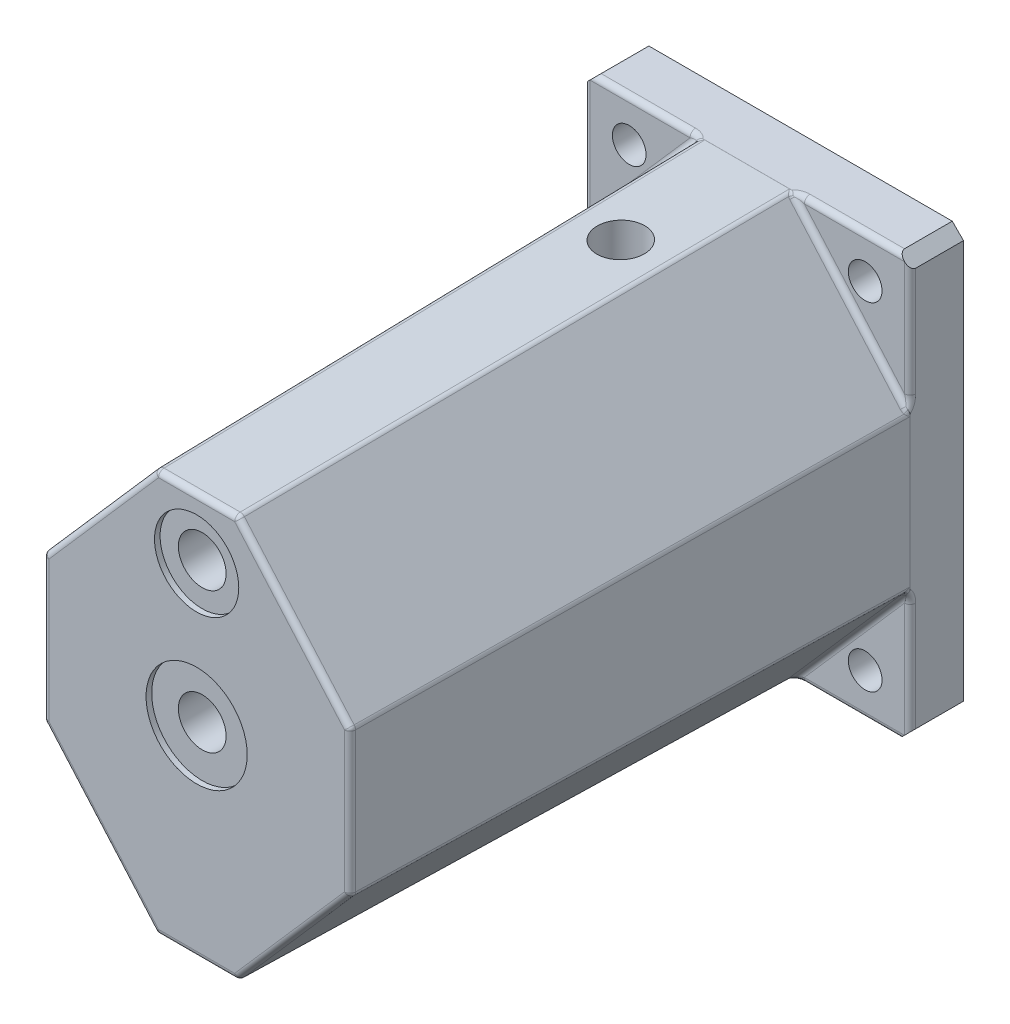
SolidWorks part; units mm, degrees
ref_plane "Face" through (0, 0, 0) normal (0, 0, 1) x (1, 0, 0)
ref_plane "Dessus" through (0, 0, 0) normal (0, 1, 0) x (1, 0, 0)
ref_plane "Droite" through (0, 0, 0) normal (1, 0, 0) x (0, 0, -1)
sketch "Esquisse1" plane through (0, 0, 0) normal (0, 0, 1) x (1, 0, 0)
  line L0 (0, 0) -> (0, 42.8954) construction
  line L1 (-29, 37.5) -> (29, 37.5)
  line L2 (-29, 37.5) -> (-29, -37.5)
  line L3 (-29, -37.5) -> (29, -37.5)
  line L4 (29, 37.5) -> (29, -37.5)
  line L5 (0, 0) -> (74.0043, 0) construction
  dimension "D1" = 58
  dimension "D2" = 75
extrude "Extrusion1" add sketch "Esquisse1" along normal blind 9.5
sketch "Esquisse2" plane through (0, 0, 9.5) normal (0, 0, 1) x (1, 0, 0)
  line L0 (-8, 37.5) -> (8, 37.5)
  line L1 (29, 37.5) -> (-29, 37.5) construction
  line L2 (8, 37.5) -> (29, 13.5)
  line L3 (29, -37.5) -> (29, 37.5) construction
  line L4 (29, 13.5) -> (29, -13.5)
  line L5 (29, -13.5) -> (8, -37.5)
  line L6 (-29, -37.5) -> (29, -37.5) construction
  line L7 (8, -37.5) -> (-8, -37.5)
  line L8 (-8, -37.5) -> (-29, -13.5)
  line L9 (-29, 37.5) -> (-29, -37.5) construction
  line L10 (-29, -13.5) -> (-29, 13.5)
  line L11 (-29, 13.5) -> (-8, 37.5)
  line L12 (0, 0) -> (0, 41.4667) construction
  line L13 (0, 0) -> (42.8837, 0) construction
  dimension "D1" = 16
  dimension "D2" = 27
extrude "Extrusion2" add sketch "Esquisse2" along normal blind 98 draft 1
sketch "Esquisse3" plane through (0, 0, 0) normal (0, 0, -1) x (-1, 0, 0)
  circle A0 centre (0, 0) radius 22
  dimension "D1" = 44
extrude "Extrusion3" add sketch "Esquisse3" along normal blind 2.5
sketch "Esquisse4" plane through (0, 0, 0) normal (0, 1, 0) x (1, 0, 0)
  line L0 (0, 0) -> (0, -124.1658) construction
  line L1 (22, 2.5) -> (-22, 2.5) construction
  line L2 (-20, 2.5) -> (-20, -3.65)
  line L3 (-20, -3.65) -> (-21.25, -3.65)
  line L4 (-21.25, -3.65) -> (-21.25, -5.5)
  line L5 (-21.25, -5.5) -> (-20, -5.5)
  line L6 (-20, -5.5) -> (-20, -92.5)
  line L7 (-20, -92.5) -> (-15.4804, -92.5)
  line L8 (-4.25, -96.5) -> (-4.25, -107.5)
  line L9 (7.2238, -107.5) -> (-7.2238, -107.5) construction
  line L10 (-4.25, -107.5) -> (0, -107.5)
  line L11 (0, -107.5) -> (0, 2.5)
  line L12 (0, 2.5) -> (-20, 2.5)
  arc A0 (-15.4804, -92.5) -> (-4.25, -96.5) centre (0, -66.8026) ccw
  dimension "D7" = 30
  dimension "D1" = 40
  dimension "D2" = 8
  dimension "D3" = 1.85
  dimension "D4" = 42.5
  dimension "D5" = 95
  dimension "D6" = 8.5
  dimension "D8" = 4
revolve "Enlèvement de matière-Révolution1" cut sketch "Esquisse4" angle 360 about L0
fillet "Congé2" radius 1 8 edges at (0, 35.7894, 107.5) (17.2566, 24.3233, 107.5) (27.2894, 0, 107.5) (17.2566, -24.3233, 107.5) (0, -35.7894, 107.5) (-17.2566, -24.3233, 107.5) (-27.2894, 0, 107.5) (-17.2566, 24.3233, 107.5)
fillet "Congé3" radius 1 16 edges at (7.0959, -35.5076, 107.2133) (-7.0959, -35.5076, 107.2133) (-27.0076, -12.7514, 107.2133) (-27.0076, 12.7514, 107.2133) (27.0076, -12.7514, 107.2133) (27.0076, 12.7514, 107.2133) (7.0959, 35.5076, 107.2133) (-7.0959, 35.5076, 107.2133)
fillet "Congé4" radius 1 12 edges at (28.9361, 13.476, 9.5) (7.9595, 37.4106, 9.5) (-7.9595, 37.4106, 9.5) (-28.9361, 13.476, 9.5) (-28.9361, -13.476, 9.5) (-7.9595, -37.4106, 9.5) (7.9595, -37.4106, 9.5) (28.9361, -13.476, 9.5)
fillet "Congé5" radius 1 8 edges
fillet "Congé7" radius 1 4 edges
chamfer "Chanfrein1" distance 2 angle 45 4 edges at (29, 37.5, 4.25) (29, -37.5, 4.25) (-29, -37.5, 4.25) (-29, 37.5, 4.25)
sketch "Esquisse5" plane through (0, 0, 0) normal (0, 0, -1) x (-1, 0, 0)
  line L0 (0, 0) -> (0, 41.2163) construction
  line L1 (0, 0) -> (-42.4587, 0) construction
  circle A0 centre (-21, 30) radius 3
  circle A1 centre (21, 30) radius 3
  circle A2 centre (21, -30) radius 3
  circle A3 centre (-21, -30) radius 3
  dimension "D1" = 6
  dimension "D2" = 30
  dimension "D3" = 21
extrude "Enlèv. mat.-Extru.1" cut sketch "Esquisse5" against normal through all
sketch "Esquisse6" plane through (0, 0, 107.5) normal (0, 0, 1) x (1, 0, 0)
  circle A0 centre (0, 0) radius 9
  dimension "D1" = 18
extrude "Enlèv. mat.-Extru.2" cut sketch "Esquisse6" against normal blind 1
sketch "Esquisse8" plane through (0, 0, 0) normal (1, 0, 0) x (0, 0, -1)
  line L0 (-107.5, 25) -> (8.8339, 25) construction
  line L1 (-107.5, 12.488) -> (-107.5, 34.8067) construction
  line L2 (-106.5, 29.25) -> (-93.5, 29.25)
  line L3 (-93.5, 29.25) -> (-92.201, 27)
  line L4 (-92.201, 27) -> (-20.6547, 27)
  line L5 (-20.6547, 27) -> (-19.5, 25)
  line L6 (-19.5, 25) -> (-107.5, 25)
  line L7 (-107.5, 25) -> (-107.5, 32.5)
  line L8 (-106.5, 29.25) -> (-106.5, 32.5)
  line L9 (-106.5, 32.5) -> (-107.5, 32.5)
  dimension "D1" = 25
  dimension "D2" = 4
  dimension "D3" = 60
  dimension "D4" = 88
  dimension "D5" = 8.5
  dimension "D6" = 60
  dimension "D7" = 14
  dimension "D8" = 7.5
  dimension "D9" = 1
revolve "Enlèvement de matière-Révolution2" cut sketch "Esquisse8" angle 360 about L0
sketch "Esquisse9" plane through (0, 0, 0) normal (0, 1, 0) x (1, 0, 0)
  line L0 (27, 0) -> (-27, 0) construction
  circle A0 centre (0, -32) radius 4.25
  dimension "D1" = 8.5
  dimension "D2" = 32
extrude "Enlèv. mat.-Extru.3" cut sketch "Esquisse9" along normal through all
sketch "Esquisse10" plane through (0, 0, -2.5) normal (0, 0, -1) x (-1, 0, 0)
  line L1 (0, 0) -> (35.1239, 0)
  line L2 (0, 0) -> (0, -39.4495)
  line L3 (0, -39.4495) -> (35.1239, -39.4495)
  line L4 (35.1239, 0) -> (35.1239, -39.4495)
extrude "Enlèv. mat.-Extru.4" [suppressed] cut sketch "Esquisse10" against normal through all
